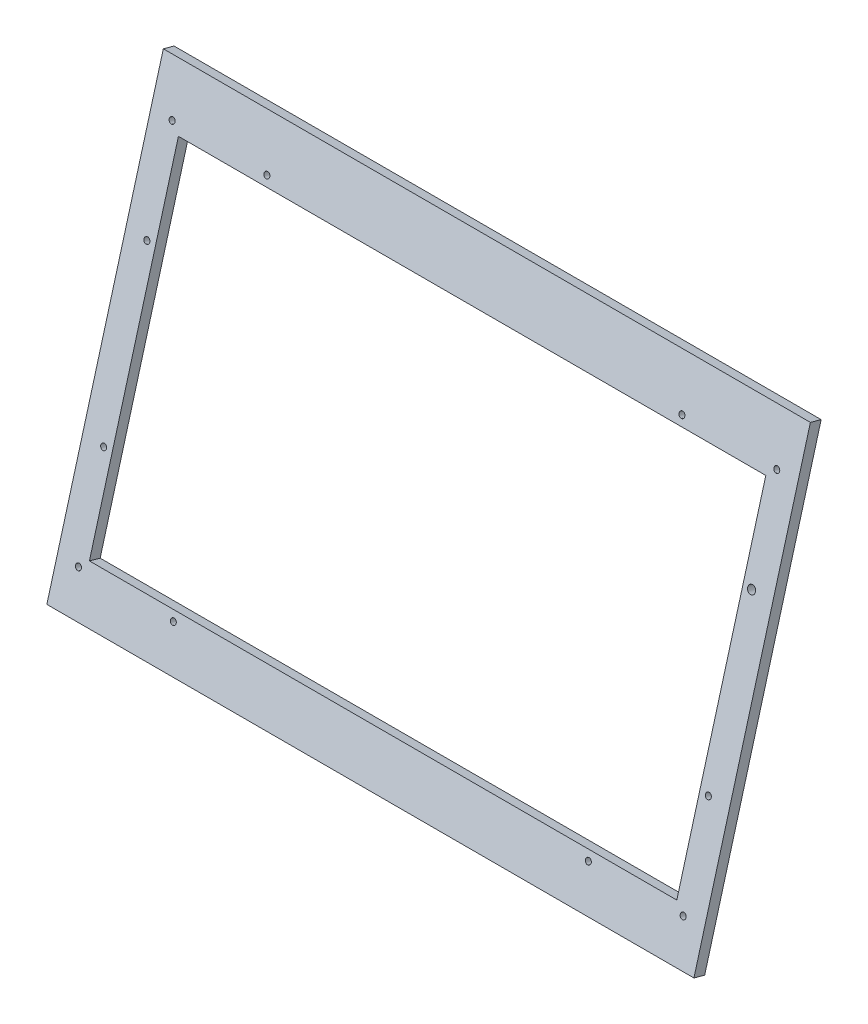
SolidWorks part; units mm, degrees
ref_plane "Plan de face" through (0, 0, 0) normal (0, 0, 1) x (1, 0, 0)
ref_plane "Plan de dessus" through (0, 0, 0) normal (0, 1, 0) x (1, 0, 0)
ref_plane "Plan de droite" through (0, 0, 0) normal (1, 0, 0) x (0, 0, -1)
sketch "Esquisse2" plane through (0, 0, 0) normal (1, 0, 0) x (0, 0, -1)
  line L11 (12.1264, -6.0768) -> (-92.2724, -385.1744)
  line L20 (-92.2724, -385.1744) -> (-101.9135, -382.5194)
  line L21 (-101.9135, -382.5194) -> (2.4853, -3.4218)
  line L22 (2.4853, -3.4218) -> (12.1264, -6.0768)
  dimension "D1" = 10
  dimension "D2" = 393.21
extrude "Boss.-Extru.3" add sketch "Esquisse2" along normal blind 600
sketch "Esquisse6" plane through (0, -0.8774, -3.186) normal (0, 0.2655, 0.9641) x (1, 0, 0)
  line L0 (600, -2.6391) -> (600, -395.8491) construction
  line L1 (36.75, -52.3891) -> (563.25, -52.3891)
  line L2 (36.75, -52.3891) -> (36.75, -352.8891)
  line L3 (36.75, -352.8891) -> (563.25, -352.8891)
  line L4 (563.25, -52.3891) -> (563.25, -352.8891)
  line L5 (600, -2.6391) -> (0, -2.6391) construction
  dimension "D1" = 300.5
  dimension "D2" = 526.5
  dimension "D3" = 36.75
  dimension "D4" = 49.75
extrude "Enlèv. mat.-Extru.1" cut sketch "Esquisse6" against normal blind 500
sketch "Esquisse7" plane through (0, -0.8774, -3.186) normal (0, 0.2655, 0.9641) x (1, 0, 0)
  line L1 (0, -2.6391) -> (10, -2.6391)
  line L2 (0, -2.6391) -> (0, -395.8491)
  line L3 (0, -395.8491) -> (10, -395.8491)
  line L4 (10, -2.6391) -> (10, -395.8491)
  line L6 (600, -2.6391) -> (590, -2.6391)
  line L7 (600, -2.6391) -> (600, -395.8491)
  line L8 (600, -395.8491) -> (590, -395.8491)
  line L9 (590, -2.6391) -> (590, -395.8491)
  dimension "D1" = 393.21
  dimension "D2" = 10
  dimension "D3" = 393.21
  dimension "D4" = 10
extrude "Enlèv. mat.-Extru.2" cut sketch "Esquisse7" against normal blind 10
sketch "Esquisse8" plane through (0, -3.5324, -12.8271) normal (0, -0.2655, -0.9641) x (-1, 0, 0)
  line L0 (-563.25, -52.3891) -> (-36.75, -52.3891) construction
  line L1 (-563.25, -352.8891) -> (-563.25, -52.3891) construction
  line L2 (-36.75, -352.8891) -> (-563.25, -352.8891) construction
  line L3 (-36.75, -52.3891) -> (-36.75, -352.8891) construction
  circle A1 centre (-571, -129.6391) radius 3.521
  circle A2 centre (-486, -44.6391) radius 2.6
  circle A3 centre (-571, -275.6391) radius 2.6
  circle A5 centre (-486, -360.6391) radius 2.6
  circle A6 centre (-114, -360.6391) radius 2.6
  circle A7 centre (-29, -275.6391) radius 2.6
  circle A9 centre (-29, -129.6391) radius 2.6
  circle A10 centre (-114, -44.6391) radius 2.6
  circle A12 centre (-571, -44.6391) radius 2.6
  circle A13 centre (-571, -360.6391) radius 2.6
  circle A14 centre (-29, -360.6391) radius 2.6
  circle A15 centre (-29, -44.6391) radius 2.6
  dimension "D1" = 7.75
  dimension "D2" = 7.75
  dimension "D3" = 7.75
  dimension "D4" = 7.75
  dimension "D5" = 7.75
  dimension "D6" = 7.75
  dimension "D7" = 7.75
  dimension "D8" = 7.75
extrude "Enlèv. mat.-Extru.3" cut sketch "Esquisse8" against normal blind 10
